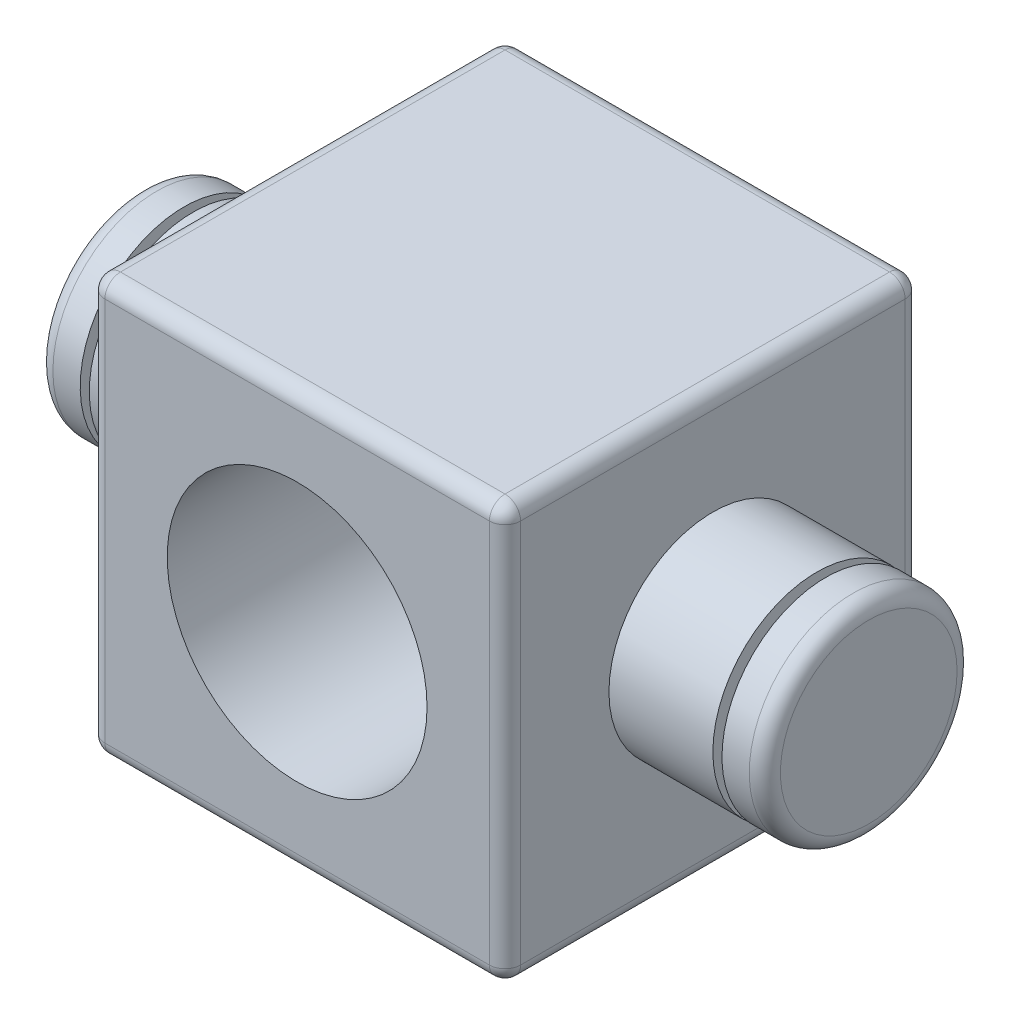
SolidWorks part; units mm, degrees
ref_plane "Plan de face" through (0, 0, 0) normal (0, 0, 1) x (1, 0, 0)
ref_plane "Plan de dessus" through (0, 0, 0) normal (0, 1, 0) x (1, 0, 0)
ref_plane "Plan de droite" through (0, 0, 0) normal (1, 0, 0) x (0, 0, -1)
sketch "Esquisse1" plane through (0, 0, 0) normal (0, 0, 1) x (1, 0, 0)
  line L1 (0, 0) -> (80, 0)
  line L2 (0, 0) -> (0, 80)
  line L3 (0, 80) -> (80, 80)
  line L4 (80, 0) -> (80, 80)
  circle A0 centre (40, 40) radius 25
  dimension "D3" = 50
  dimension "D1" = 80
  dimension "D2" = 80
  dimension "D4" = 40
  dimension "D5" = 40
extrude "Boss.-Extru.1" add sketch "Esquisse1" along normal blind 80
sketch "Esquisse2" plane through (80, 0, 0) normal (1, 0, 0) x (0, 0, -1)
  line L0 (-80, 80) -> (0, 80) construction
  line L1 (0, 0) -> (0, 80) construction
  circle A0 centre (-40, 40) radius 20
  dimension "D1" = 40
  dimension "D2" = 40
  dimension "D3" = 40
extrude "Boss.-Extru.2" add sketch "Esquisse2" along normal blind 30
sketch "Esquisse3" plane through (0, 0, 0) normal (-1, 0, 0) x (0, 0, 1)
  line L0 (80, 80) -> (0, 80) construction
  line L1 (80, 80) -> (80, 0) construction
  circle A0 centre (40, 40) radius 20
  dimension "D1" = 40
  dimension "D2" = 40
  dimension "D3" = 40
extrude "Boss.-Extru.3" add sketch "Esquisse3" along normal blind 30
fillet "Congé1" radius 3 14 edges at (0, 0, 40) (40, 0, 80) (0, 40, 80) (40, 80, 80) (80, 40, 80) (0, 40, 0) (80, 0, 40) (40, 0, 0) (80, 40, 0) (80, 80, 40) (40, 80, 0) (-30, 40, 60) (0, 80, 40) (110, 40, 20)
ref_plane "Plan1" through (0, 0, 40) normal (0, 0, 1) x (1, 0, 0)
sketch "Esquisse4" plane through (0, 0, 40) normal (0, 0, 1) x (1, 0, 0)
  line L0 (0, 60) -> (-27, 60) construction
  line L1 (-21.75, 60) -> (-20, 60)
  line L2 (-21.75, 60) -> (-21.75, 57.5)
  line L3 (-21.75, 57.5) -> (-20, 57.5)
  line L4 (-20, 60) -> (-20, 57.5)
  line L6 (107, 60) -> (80, 60) construction
  line L7 (100, 60) -> (101.75, 60)
  line L8 (100, 60) -> (100, 57.5)
  line L9 (100, 57.5) -> (101.75, 57.5)
  line L12 (-30, 40) -> (110, 40) construction
  line L15 (-30, 57) -> (-30, 23) construction
  line L16 (110, 23) -> (110, 57) construction
  line L17 (101.75, 60) -> (101.75, 57.5)
  dimension "D1" = 2.5
  dimension "D2" = 1.75
  dimension "D3" = 10
  dimension "D4" = 2.5
  dimension "D5" = 1.75
  dimension "D6" = 10
revolve "Enlèvement de matière-Révolution1" cut sketch "Esquisse4" angle 360 about L12
